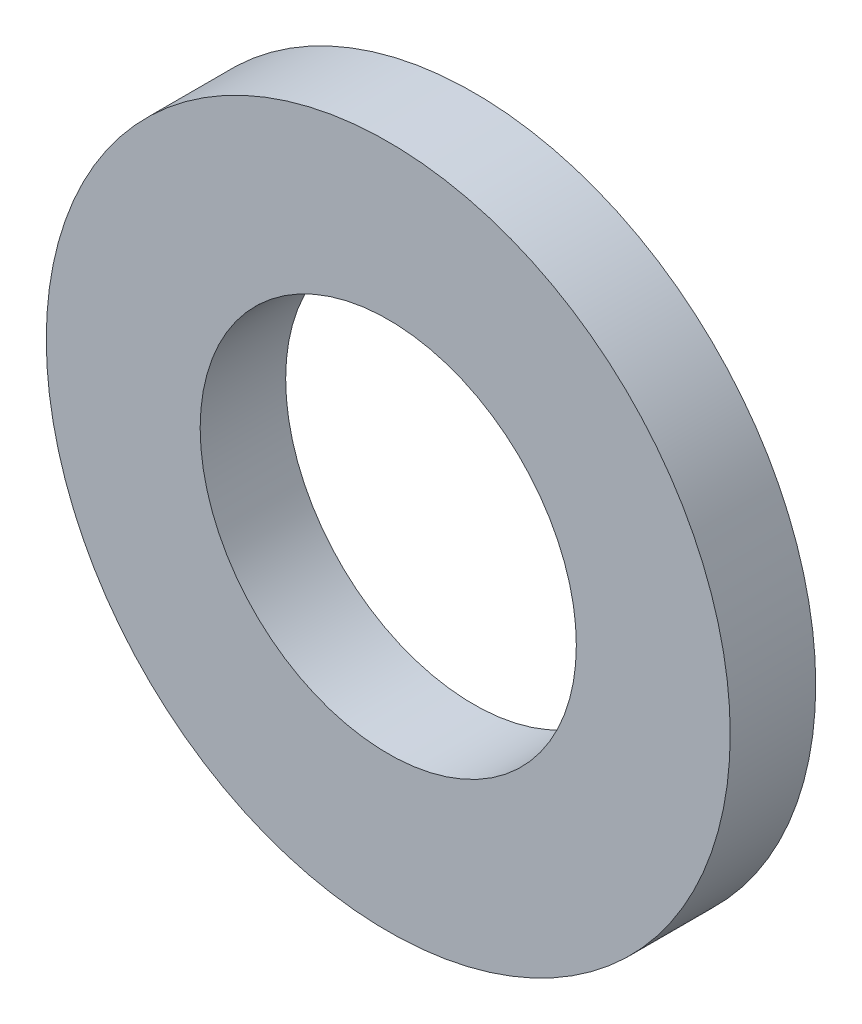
SolidWorks part; units mm, degrees
ref_plane "Plan de face" through (0, 0, 0) normal (0, 0, 1) x (1, 0, 0)
ref_plane "Plan de dessus" through (0, 0, 0) normal (0, 1, 0) x (1, 0, 0)
ref_plane "Plan de droite" through (0, 0, 0) normal (1, 0, 0) x (0, 0, -1)
sketch "Esquisse1" plane through (0, 0, 0) normal (0, 0, 1) x (1, 0, 0)
  circle A0 centre (0, 0) radius 2
  circle A1 centre (0, 0) radius 1.1
  dimension "D1" = 2.2
  dimension "D2" = 4
extrude "Extrusion1" add sketch "Esquisse1" along normal blind 0.5
